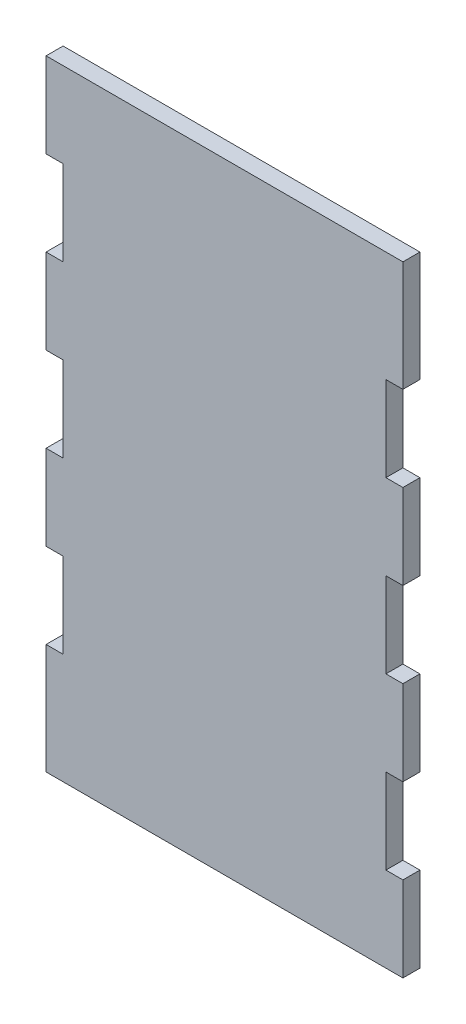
SolidWorks part; units mm, degrees
ref_plane "Front Plane" through (0, 0, 0) normal (0, 0, 1) x (1, 0, 0)
ref_plane "Top Plane" through (0, 0, 0) normal (0, 1, 0) x (1, 0, 0)
ref_plane "Right Plane" through (0, 0, 0) normal (1, 0, 0) x (0, 0, -1)
sketch "Sketch1" plane through (0, 0, 0) normal (0, 0, 1) x (1, 0, 0)
  line L0 (28, -2) -> (28, 67) construction
  line L1 (-12, -4) -> (30, -4)
  line L2 (-12, -4) -> (-12, 69)
  line L3 (-12, 69) -> (30, 69)
  line L4 (30, -4) -> (30, 69)
  line L5 (-10, 67) -> (-10, -2) construction
  line L6 (0, 67) -> (18, 67) construction
  line L7 (18, -2) -> (0, -2) construction
extrude "Boss-Extrude1" add sketch "Sketch1" along normal blind 2
other "Cavity1"
other "batteryCoverSide<1>@batteryPackNCase1"
other "batteryCoverSide<2>@batteryPackNCase1"
equation "\"anch\" = 2"
equation "\"alt\" = 100"
equation "\"pilanch\" = 100"
equation "\"pilalt\" = 250"
equation "\"bodyHeigh\" = 60"
equation "\"dorsalFinHeigh\" = 400"
equation "\"D3@Sketch1\"=\"anch\""
equation "\"D4@Sketch1\"=\"anch\""
equation "\"D1@Sketch1\"=\"anch\""
equation "\"D2@Sketch1\"=\"anch\""
equation "\"D1@Boss-Extrude1\"=\"anch\""
